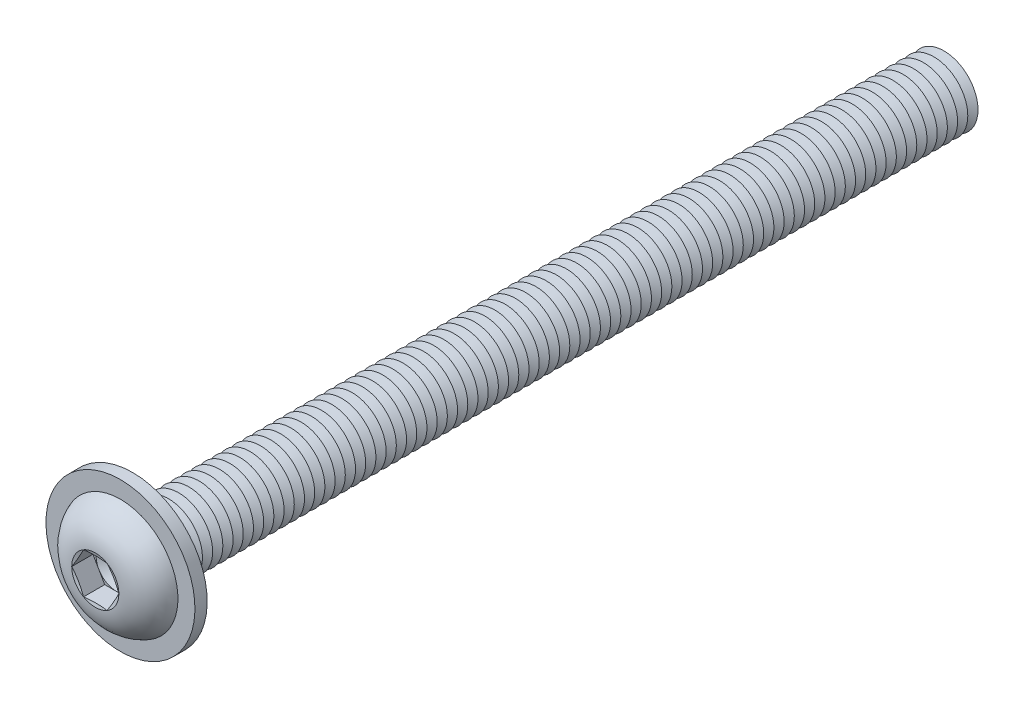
SolidWorks part; units mm, degrees
ref_plane "Front Plane" through (0, 0, 0) normal (0, 0, 1) x (1, 0, 0)
ref_plane "Top Plane" through (0, 0, 0) normal (0, 1, 0) x (1, 0, 0)
ref_plane "Right Plane" through (0, 0, 0) normal (1, 0, 0) x (0, 0, -1)
sketch "Sketch1" plane through (0, 0, 0) normal (1, 0, 0) x (0, 0, -1)
  line L0 (0, 5) -> (0, 8.75)
  line L3 (0, 5) -> (120, 5)
  line L4 (120, 5) -> (120, 0)
  line L5 (120, 0) -> (-5.5, 0) construction
  line L6 (-5.5, 0) -> (120, 0)
  line L7 (-5.5, 3.4641) -> (-5.5, 1.732) construction
  line L8 (-5.5, 1.732) -> (-5.5, 0)
  line L9 (-5.5, 3.4641) -> (-5.0359, 1.732)
  line L10 (-5.0359, 1.732) -> (-5.5, 1.732)
  line L11 (120, 0) -> (22.7481, 0) construction
  line L12 (0, 8.75) -> (-5.5, 8.75) construction
  arc A1 (0, 8.75) -> (-5.5, 3.4641) centre (0, 3.2457) ccw
  point P8 (120, 2.5)
  dimension "D1" = 17.5
  dimension "D2" = 10
  dimension "D3" = 5.5
  dimension "D4" = 6.9282
  dimension "D5" = 120
  dimension "D6" = 15
revolve "Revolve1" add sketch "Sketch1" angle 360 about L5
fillet "Fillet1" radius 0.75 1 edges at (-5, 0, 0)
sketch "Sketch2" plane through (0, 0, 0) normal (1, 0, 0) x (0, 0, -1)
  line L0 (119.25, 5) -> (120.75, 5)
  line L1 (120, 5) -> (0.75, 5) construction
  line L2 (120.75, 5) -> (120, 3.701)
  line L3 (120, -5) -> (120, 5) construction
  line L4 (120, 3.701) -> (119.25, 5)
  dimension "D1" = 1.5
revolve "Cut-Revolve1" cut sketch "Sketch2" angle 360 about axis through (0, 0, -120) along (0, 0, -1)
pattern_linear "LPattern1" count 80 spacing 1.5 along (0, 0, 1) of "Cut-Revolve1"
sketch "Sketch3" plane through (0, 0, 5.5) normal (0, 0, 1) x (1, 0, 0)
  line L7 (1.732, 3) -> (-1.7321, 3)
  line L8 (-1.7321, 3) -> (-3.4641, 0)
  line L9 (-3.4641, 0) -> (-1.732, -3)
  line L10 (-1.732, -3) -> (1.732, -3)
  line L11 (1.732, -3) -> (3.4641, 0)
  line L12 (3.4641, 0) -> (1.732, 3)
  circle A0 centre (0, 0) radius 3 construction
  circle A3 centre (0, 0) radius 3.4641 construction
extrude "Cut-Extrude1" cut sketch "Sketch3" against normal blind 3.12
sketch "Sketch4" plane through (0, 0, 2.38) normal (0, 0, 1) x (1, 0, 0)
  line L1 (1.732, 3) -> (-1.7321, 3) construction
  circle A0 centre (0, 0) radius 3
extrude "Cut-Extrude2" cut sketch "Sketch4" against normal through all draft 60
sketch "Sketch5" plane through (0, 0, 0) normal (0, 0, -1) x (-1, 0, 0)
  circle A0 centre (0, 0) radius 10.95
  circle A1 centre (0, 0) radius 5.75
  circle A2 centre (0, 0) radius 5.75 construction
  dimension "D1" = 21.9
extrude "Boss-Extrude1" add sketch "Sketch5" against normal blind 1.8
